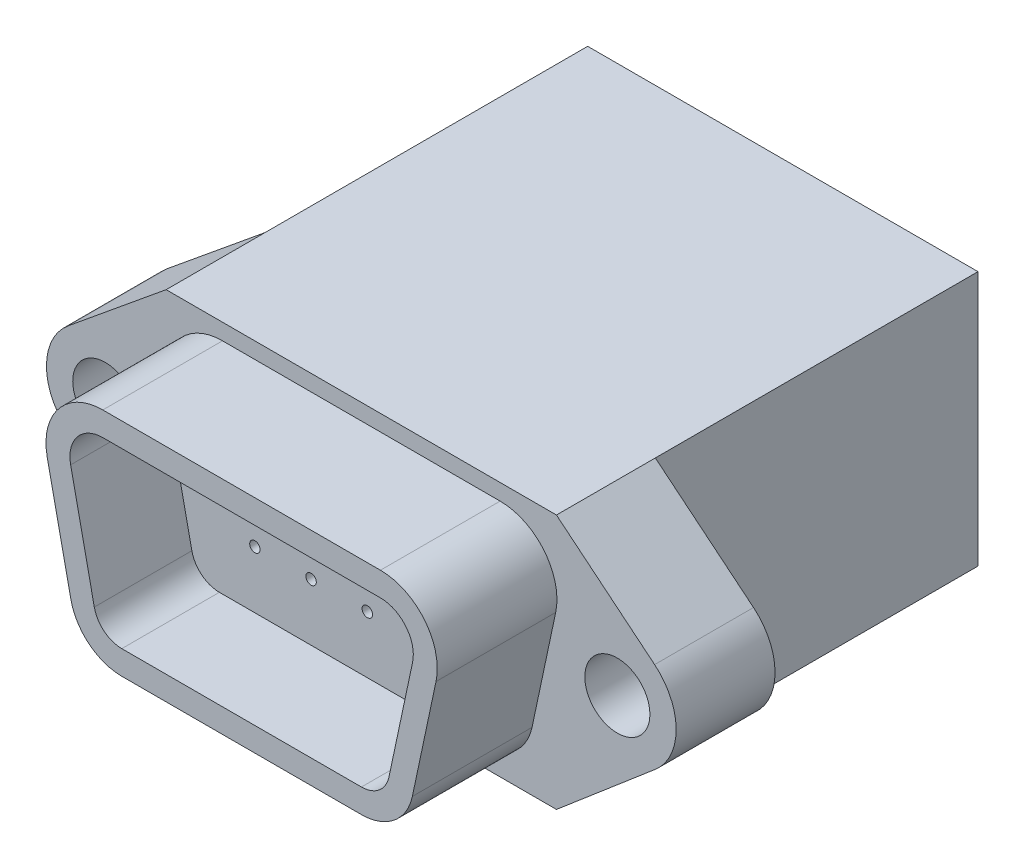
SolidWorks part; units mm, degrees
ref_plane "Front" through (0, 0, 0) normal (0, 0, 1) x (1, 0, 0)
ref_plane "Top" through (0, 0, 0) normal (0, 1, 0) x (1, 0, 0)
ref_plane "Right" through (0, 0, 0) normal (1, 0, 0) x (0, 0, -1)
sketch "Sketch1" plane through (0, 0, 0) normal (0, 0, 1) x (1, 0, 0)
  line L0 (9.4879, 0.6383) -> (8.3329, -4.7953)
  line L1 (6.7754, 3.9878) -> (-6.7754, 3.9878)
  line L2 (1.3716, -2.8448) -> (-1.3716, -2.8448) construction
  line L3 (0, -2.8448) -> (0, 0) construction
  line L4 (-9.4879, 0.6383) -> (-8.3329, -4.7953)
  line L5 (0, -1.4224) -> (17.8551, -1.4224) construction
  line L8 (-5.8484, -6.8072) -> (5.8484, -6.8072)
  arc A0 (6.7754, 3.9878) -> (9.4879, 0.6383) centre (6.7754, 1.2148) cw
  arc A3 (8.3329, -4.7953) -> (5.8484, -6.8072) centre (5.8484, -4.2672) cw
  arc A5 (-6.7754, 3.9878) -> (-9.4879, 0.6383) centre (-6.7754, 1.2148) ccw
  arc A6 (-8.3329, -4.7953) -> (-5.8484, -6.8072) centre (-5.8484, -4.2672) ccw
  circle A7 centre (5.4864, 0) radius 0.254
  circle A9 centre (2.7432, 0) radius 0.254
  circle A10 centre (0, 0) radius 0.254
  circle A12 centre (-2.7432, 0) radius 0.254
  circle A13 centre (-5.4864, 0) radius 0.254
  circle A14 centre (-4.1148, -2.8448) radius 0.254
  circle A15 centre (-1.3716, -2.8448) radius 0.254
  circle A16 centre (1.3716, -2.8448) radius 0.254
  circle A17 centre (4.1148, -2.8448) radius 0.254
  dimension "D1" = 78
  dimension "D2" = 1.3716
  dimension "D3" = 2.7432
  dimension "D4" = 2.7432
  dimension "D5" = 2.7432
  dimension "D6" = 2.7432
  dimension "D7" = 2.7432
  dimension "D8" = 2.7432
  dimension "D9" = 2.7432
  dimension "D10" = 3.9624
  dimension "D11" = 2.54
  dimension "D12" = 2.773
  dimension "D13" = 0.508
  dimension "D16" = 6.7754
  dimension "D17" = 13.5509
  dimension "D18" = 11.6968
  dimension "D19" = 2.8448
  dimension "D22" = 19.0969
  dimension "D14" = 78
  dimension "D15" = 10.795
  dimension "D20" = 5.4102
  dimension "D21" = 5.3848
extrude "Base-Extrude" add sketch "Sketch1" along normal blind 10.668
sketch "Sketch2" plane through (7.9689, 1.5882, 0) normal (0, 0, -1) x (-1, 0, 0)
  line L0 (7.9689, -9.259) -> (7.9689, -1.5882) construction
  line L1 (17.4939, 3.187) -> (-1.5561, 3.187)
  line L2 (7.9689, 3.187) -> (7.9689, -1.5882) construction
  line L3 (17.4939, -9.259) -> (-1.5561, -9.259)
  line L4 (-1.5561, 3.187) -> (-6.3474, -0.74)
  line L5 (-1.5561, -9.259) -> (-6.3884, -5.1453)
  line L6 (17.4939, 3.187) -> (22.2851, -0.74)
  line L7 (17.4939, -9.259) -> (22.3262, -5.1453)
  arc A1 (-6.3474, -0.74) -> (-6.3884, -5.1453) centre (-4.5279, -2.9598) ccw
  arc A3 (22.3262, -5.1453) -> (22.2851, -0.74) centre (20.4657, -2.9598) ccw
  circle A8 centre (13.4553, -1.5882) radius 0.254 construction
  circle A9 centre (20.4657, -2.9598) radius 1.5875
  circle A10 centre (-4.5279, -2.9598) radius 1.5875
  dimension "D5" = 19.05
  dimension "D6" = 4.7752
  dimension "D8" = 6.2992
  dimension "D10" = 3.175
  dimension "D11" = 24.9936
  dimension "D2" = 30.734
  dimension "D3" = 12.446
  dimension "D4" = 19.05
  dimension "D12" = 12.4968
  dimension "D13" = 1.3716
extrude "Boss-Extrude1" add sketch "Sketch2" against normal blind 4.826
sketch "Sketch9" plane through (0, 0, 10.668) normal (0, 0, 1) x (1, 0, 0)
  line L8 (6.7754, 2.8194) -> (-6.7754, 2.8194)
  line L9 (-8.345, 0.8812) -> (-7.19, -4.5524)
  line L10 (-5.8484, -5.6388) -> (5.8484, -5.6388)
  line L11 (7.19, -4.5524) -> (8.345, 0.8812)
  line L12 (6.7754, 2.8194) -> (-6.7754, 2.8194)
  line L13 (-8.345, 0.8812) -> (-7.19, -4.5524)
  line L14 (-5.8484, -5.6388) -> (5.8484, -5.6388)
  line L15 (7.19, -4.5524) -> (8.345, 0.8812)
  arc A8 (8.345, 0.8812) -> (6.7754, 2.8194) centre (6.7754, 1.2148) ccw
  arc A9 (-6.7754, 2.8194) -> (-8.345, 0.8812) centre (-6.7754, 1.2148) ccw
  arc A10 (-7.19, -4.5524) -> (-5.8484, -5.6388) centre (-5.8484, -4.2672) ccw
  arc A11 (5.8484, -5.6388) -> (7.19, -4.5524) centre (5.8484, -4.2672) ccw
  arc A12 (8.345, 0.8812) -> (6.7754, 2.8194) centre (6.7754, 1.2148) ccw
  arc A13 (-6.7754, 2.8194) -> (-8.345, 0.8812) centre (-6.7754, 1.2148) ccw
  arc A14 (-7.19, -4.5524) -> (-5.8484, -5.6388) centre (-5.8484, -4.2672) ccw
  arc A15 (5.8484, -5.6388) -> (7.19, -4.5524) centre (5.8484, -4.2672) ccw
  dimension "D2" = 16.7601
  dimension "D1" = 1.1684
extrude "Cut-Extrude3" cut sketch "Sketch9" against normal blind 4.7625
sketch "Sketch3" plane through (4.149, -0.2484, 0) normal (0, 0, -1) x (-1, 0, 0)
  line L0 (-5.376, 5.0236) -> (13.674, 5.0236)
  line L1 (13.674, 5.0236) -> (-5.376, 5.0236) construction
  line L2 (13.674, 5.0236) -> (13.674, -7.4224)
  line L3 (13.674, -7.4224) -> (-5.376, -7.4224)
  line L4 (-5.376, -7.4224) -> (13.674, -7.4224) construction
  line L7 (-5.376, -7.4224) -> (-5.376, 5.0236)
  dimension "D1" = 19.05
  dimension "D2" = 9.525
extrude "Boss-Extrude2" add sketch "Sketch3" along normal blind 15.748
